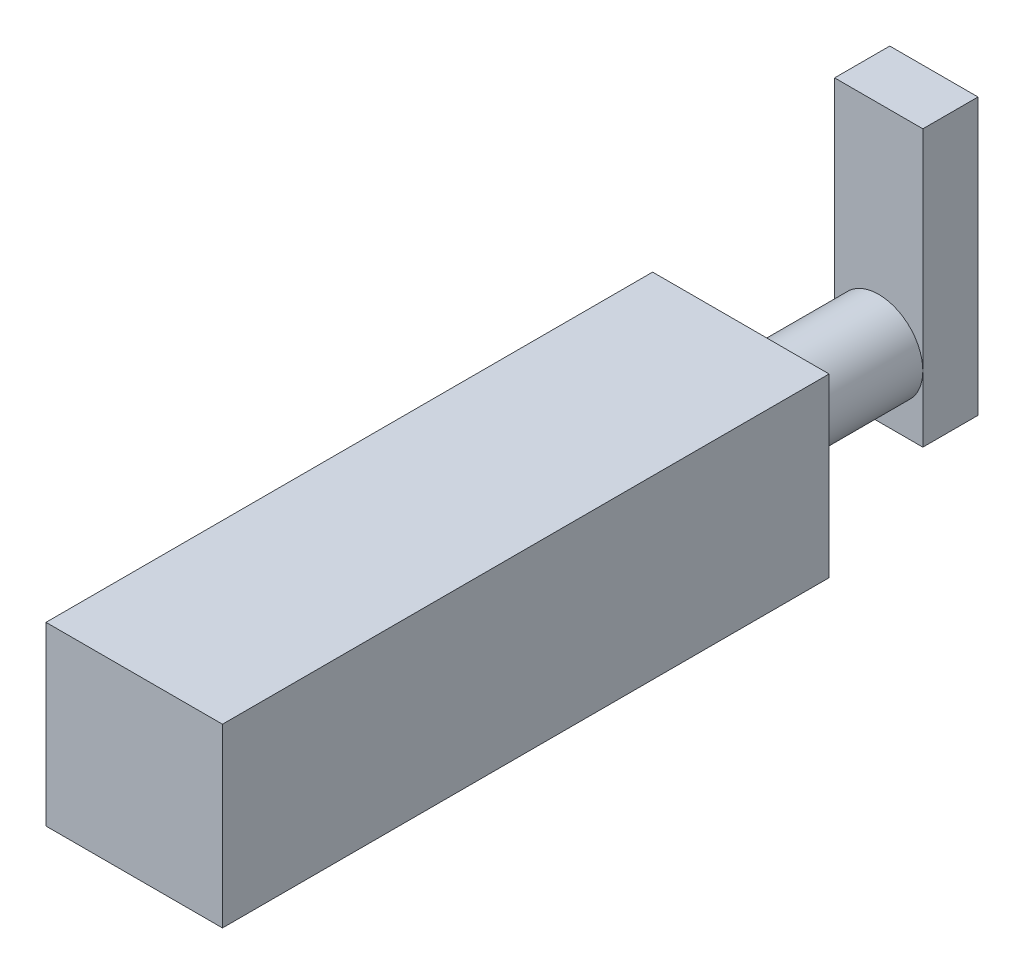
SolidWorks part; units mm, degrees
ref_plane "Plan de face" through (0, 0, 0) normal (0, 0, 1) x (1, 0, 0)
ref_plane "Plan de dessus" through (0, 0, 0) normal (0, 1, 0) x (1, 0, 0)
ref_plane "Plan de droite" through (0, 0, 0) normal (1, 0, 0) x (0, 0, -1)
sketch "Esquisse1" plane through (0, 0, 0) normal (0, 0, 1) x (1, 0, 0)
  circle A0 centre (0, 0) radius 8
extrude "Boss.-Extru.1" add sketch "Esquisse1" along normal blind 80
sketch "Esquisse2" plane through (0, 0, 0) normal (0, 0, -1) x (-1, 0, 0)
  line L1 (-8, -12) -> (8, -12)
  line L2 (-8, -12) -> (-8, 38)
  line L3 (-8, 38) -> (8, 38)
  line L4 (8, -12) -> (8, 38)
  dimension "D1" = 16
  dimension "D2" = 8
  dimension "D3" = 50
  dimension "D4" = 12
extrude "Boss.-Extru.2" add sketch "Esquisse2" along normal blind 10
ref_plane "Plan1" through (0, 0, 10) normal (0, 0, 1) x (1, 0, 0)
sketch "Esquisse3" plane through (0, 0, 10) normal (0, 0, 1) x (1, 0, 0)
  circle A0 centre (0, 0) radius 22
sketch "Esquisse4" plane through (0, 0, 80) normal (0, 0, 1) x (1, 0, 0)
  line L0 (0, 16) -> (0, -16)
  line L1 (0, 19.825) -> (0, -20.368) construction
  arc A0 (0, -16) -> (0, 16) centre (0, 0) ccw
sketch "Esquisse5" plane through (0, 0, 0) normal (0, 1, 0) x (1, 0, 0)
  line L0 (0, -80) -> (20, -80)
  line L1 (0, -80) -> (16, -80) construction
  line L2 (20, -80) -> (0, -110)
  line L3 (0, -110) -> (-20, -80)
  line L4 (-20, -80) -> (0, -80)
  dimension "D1" = 30
  dimension "D2" = 20
  dimension "D3" = 20
sketch "Esquisse6" plane through (0, 0, 80) normal (0, 0, 1) x (1, 0, 0)
  line L1 (-16, 16) -> (16, 16)
  line L2 (-16, 16) -> (-16, -16)
  line L3 (-16, -16) -> (16, -16)
  line L4 (16, 16) -> (16, -16)
extrude "Boss.-Extru.3" add sketch "Esquisse6" against normal mid plane 110
